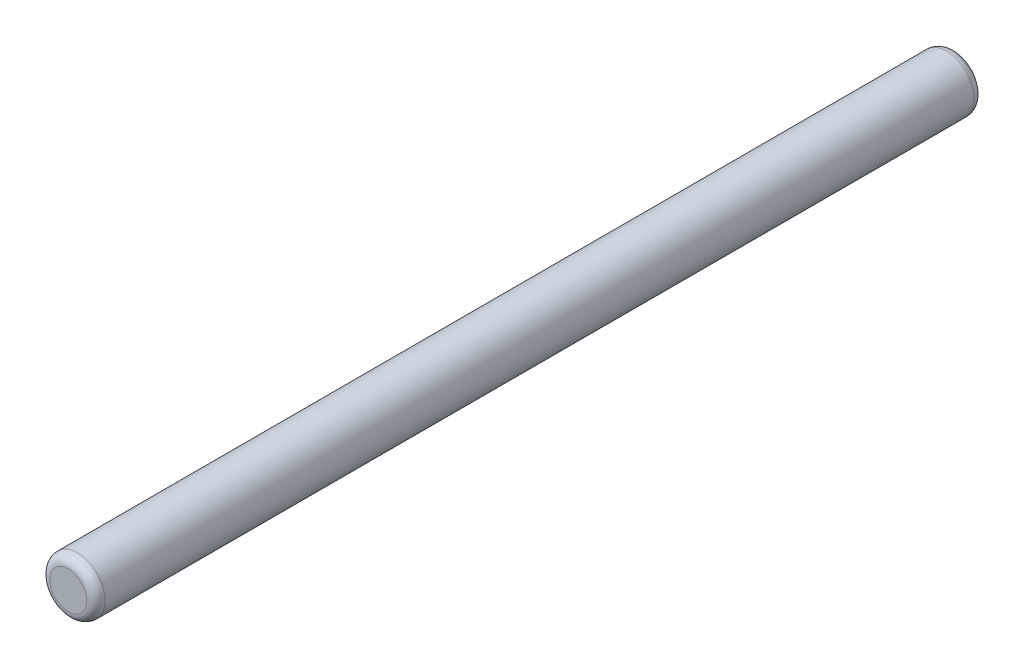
SolidWorks part; units mm, degrees
ref_plane "Face" through (0, 0, 0) normal (0, 0, 1) x (1, 0, 0)
ref_plane "Dessus" through (0, 0, 0) normal (0, 1, 0) x (1, 0, 0)
ref_plane "Droite" through (0, 0, 0) normal (1, 0, 0) x (0, 0, -1)
sketch "Esquisse1" plane through (0, 0, 0) normal (0, 0, 1) x (1, 0, 0)
  circle A0 centre (0, 0) radius 1.5
  dimension "D1" = 3
extrude "Extrusion1" add sketch "Esquisse1" along normal blind 48
fillet "Congé1" radius 0.5
